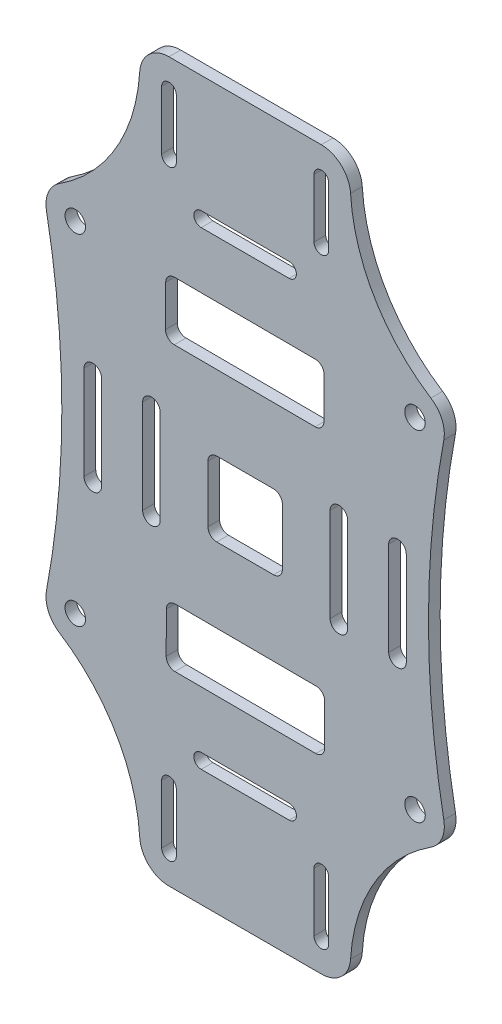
SolidWorks part; units mm, degrees
ref_plane "Front Plane" through (0, 0, 0) normal (0, 0, 1) x (1, 0, 0)
ref_plane "Top Plane" through (0, 0, 0) normal (0, 1, 0) x (1, 0, 0)
ref_plane "Right Plane" through (0, 0, 0) normal (1, 0, 0) x (0, 0, -1)
sketch "Sketch2" plane through (0, 0, 0) normal (0, 0, 1) x (1, 0, 0)
  line L0 (22.5, 22.5) -> (15.25, 15.25) construction
  line L1 (-88.3883, -88.3883) -> (88.3883, -88.3883) construction
  line L2 (-88.3883, -88.3883) -> (-88.3883, 88.3883) construction
  line L3 (88.3883, 88.3883) -> (80.3883, 88.3883) construction
  line L4 (88.3883, -88.3883) -> (88.3883, 88.3883) construction
  line L5 (-22.5, 22.5) -> (-15.25, 15.25) construction
  line L6 (-22.5, -22.5) -> (-15.25, -15.25) construction
  line L7 (15.25, -15.25) -> (22.5, -22.5) construction
  line L8 (-15.25, -15.25) -> (15.25, -15.25) construction
  line L9 (15.25, -15.25) -> (15.25, 15.25) construction
  line L10 (15.25, 15.25) -> (-15.25, 15.25) construction
  line L11 (-15.25, 15.25) -> (-15.25, -15.25) construction
  line L12 (0, 0) -> (28.9914, 28.9914) construction
  line L13 (18.875, 18.875) -> (24.1783, 13.5717) construction
  line L14 (18.875, 18.875) -> (13.4605, 24.0648) construction
  line L16 (16.1678, 21.4699) -> (16.4248, 21.727)
  line L17 (21.4699, 16.1678) -> (21.727, 16.4248)
  line L18 (19.4788, 26.484) -> (23.6395, 29.6392)
  line L19 (26.484, 19.4788) -> (29.6392, 23.6395)
  circle A0 centre (-22.5, 22.5) radius 1.75 construction
  circle A1 centre (22.5, 22.5) radius 1.75 construction
  circle A2 centre (22.5, -22.5) radius 1.75 construction
  circle A3 centre (-22.5, -22.5) radius 1.75 construction
  circle A4 centre (-15.25, 15.25) radius 1.75 construction
  circle A5 centre (15.25, 15.25) radius 1.75 construction
  circle A6 centre (15.25, -15.25) radius 1.75 construction
  circle A7 centre (-15.25, -15.25) radius 1.75 construction
  circle A8 centre (88.3883, 88.3883) radius 3.25
  circle A9 centre (13.4605, 24.0648) radius 1.75
  circle A10 centre (24.1783, 13.5717) radius 1.75
  circle A11 centre (28.9914, 28.9914) radius 1.75
  arc A12 (11.2589, 27.1004) -> (16.1678, 21.4699) centre (13.4605, 24.0648) ccw
  arc A13 (21.5267, 16.2233) -> (27.4519, 11.7425) centre (24.1783, 13.5717) ccw
  arc A14 (25.2432, 28.8737) -> (28.8737, 25.2432) centre (28.9914, 28.9914) ccw
  circle A15 centre (80.3883, 88.3883) radius 1.75
  circle A16 centre (88.3883, 96.3883) radius 1.75
  circle A17 centre (96.3883, 88.3883) radius 1.75
  circle A18 centre (88.3883, 80.3883) radius 1.75
  arc A19 (95.2099, 78.8213) -> (78.8213, 95.2099) centre (88.3883, 88.3883) ccw
  arc A20 (11.2589, 27.1004) -> (78.8213, 95.2099) centre (-163.3974, 267.9184) ccw
  arc A21 (27.1004, 11.2589) -> (95.2099, 78.8213) centre (267.9184, -163.3974) cw
  arc A22 (23.8811, 17.6945) -> (26.484, 19.4788) centre (22.5, 22.5) ccw
  arc A23 (19.4788, 26.484) -> (17.6945, 23.8811) centre (22.5, 22.5) ccw
  arc A24 (29.6392, 23.6395) -> (28.8737, 25.2432) centre (28.8424, 24.2437) ccw
  arc A25 (23.6395, 29.6392) -> (25.2432, 28.8737) centre (24.2437, 28.8424) cw
  arc A26 (23.8811, 17.6945) -> (21.727, 16.4248) centre (25.2623, 12.8891) ccw
  arc A27 (16.4248, 21.727) -> (17.6945, 23.8811) centre (12.8891, 25.2623) ccw
  point P0 (0, 0)
  point P6 (0, 0)
  point P15 (0, 0)
  point P39 (83.085, 93.6916)
  point P40 (23.6881, 34.2947)
  point P47 (93.6916, 83.085)
  point P48 (34.2947, 23.6881)
  point P63 (31.9794, 26.7255)
  point P66 (26.7255, 31.9794)
  dimension "D1" = 4
sketch "Sketch3" plane through (0, 0, 0) normal (0, 0, 1) x (1, 0, 0)
  line L0 (32.5269, -32.5269) -> (37.3859, -27.668)
  line L1 (32.5269, 32.5269) -> (37.3859, 27.668)
  line L2 (32.5269, 32.5269) -> (27.668, 37.3859)
  line L3 (32.5269, -32.5269) -> (27.668, -37.3859)
  line L4 (-32.5269, -32.5269) -> (-27.668, -37.3859)
  line L5 (-32.5269, -32.5269) -> (-37.3859, -27.668)
  line L6 (-32.5269, 32.5269) -> (-37.3859, 27.668)
  line L7 (-32.5269, 32.5269) -> (-27.668, 37.3859)
  line L8 (0, 0) -> (16, 0) construction
  line L9 (16, 0) -> (16, 8) construction
  line L10 (16, 0) -> (16, -8) construction
  line L11 (17.5, 0) -> (17.5, -8)
  line L12 (17.5, 0) -> (17.5, 8)
  line L13 (14.5, 0) -> (14.5, -8)
  line L14 (14.5, 0) -> (14.5, 8)
  line L15 (0, 0) -> (0, 13.4605) construction
  line L16 (24.5, 0) -> (24.5, -8)
  line L17 (27.5, 0) -> (27.5, -8)
  line L18 (27.5, 0) -> (27.5, 8)
  line L19 (24.5, 0) -> (24.5, 8)
  line L20 (-27.5, 0) -> (-27.5, -8)
  line L21 (-24.5, 0) -> (-24.5, -8)
  line L22 (-27.5, 0) -> (-27.5, 8)
  line L23 (-24.5, 0) -> (-24.5, 8)
  line L24 (-14.5, 0) -> (-14.5, 8)
  line L25 (-17.5, 0) -> (-17.5, 8)
  line L26 (-17.5, 0) -> (-17.5, -8)
  line L27 (-14.5, 0) -> (-14.5, -8)
  line L28 (0, 15.25) -> (6.35, 15.25) construction
  line L29 (15.25, 15.25) -> (-15.25, 15.25) construction
  line L30 (0, 15.25) -> (-6.35, 15.25) construction
  line L31 (0, 18.375) -> (4.85, 18.375)
  line L32 (0, 18.375) -> (-4.85, 18.375)
  line L33 (0, 12.125) -> (4.85, 12.125)
  line L34 (0, 12.125) -> (-4.85, 12.125)
  line L35 (6.35, 16.875) -> (6.35, 13.625)
  line L36 (-6.35, 16.875) -> (-6.35, 13.625)
  line L37 (0, -18.375) -> (4.85, -18.375)
  line L38 (6.35, -16.875) -> (6.35, -13.625)
  line L39 (0, -12.125) -> (4.85, -12.125)
  line L40 (0, -12.125) -> (-4.85, -12.125)
  line L41 (-6.35, -16.875) -> (-6.35, -13.625)
  line L42 (0, -18.375) -> (-4.85, -18.375)
  line L43 (0, 18.375) -> (6.35, 18.375) construction
  line L44 (0, 12.125) -> (6.35, 12.125) construction
  line L45 (0, 12.125) -> (-6.35, 12.125) construction
  line L46 (0, 18.375) -> (-6.35, 18.375) construction
  circle A0 centre (28.9914, 28.9914) radius 1.75
  circle A1 centre (24.1783, 13.5717) radius 1.75
  circle A2 centre (22.5, 22.5) radius 1.75
  circle A3 centre (13.4605, 24.0648) radius 1.75
  circle A4 centre (15.25, 15.25) radius 1.75
  circle A5 centre (-15.25, 15.25) radius 1.75
  circle A6 centre (-22.5, 22.5) radius 1.75
  circle A7 centre (-15.25, -15.25) radius 1.75
  circle A8 centre (15.25, -15.25) radius 1.75
  circle A9 centre (22.5, -22.5) radius 1.75
  circle A10 centre (-22.5, -22.5) radius 1.75
  circle A11 centre (24.0648, -13.4605) radius 1.75
  circle A12 centre (13.5717, -24.1783) radius 1.75
  circle A13 centre (28.9914, -28.9914) radius 1.75
  circle A14 centre (-13.4605, -24.0648) radius 1.75
  circle A15 centre (-24.1783, -13.5717) radius 1.75
  circle A16 centre (-28.9914, -28.9914) radius 1.75
  circle A17 centre (-24.0648, 13.4605) radius 1.75
  circle A18 centre (-13.5717, 24.1783) radius 1.75
  circle A19 centre (-28.9914, 28.9914) radius 1.75
  arc A20 (95.2099, 78.8213) -> (27.1004, 11.2589) centre (267.9184, -163.3974) ccw construction
  arc A21 (11.2589, 27.1004) -> (78.8213, 95.2099) centre (-163.3974, 267.9184) ccw construction
  arc A22 (-24.6669, 37.7927) -> (24.6669, 37.7927) centre (0, 81.2846) ccw
  arc A23 (37.7927, 24.6669) -> (37.7927, -24.6669) centre (81.2846, 0) ccw
  arc A24 (24.6669, -37.7927) -> (-24.6669, -37.7927) centre (0, -81.2846) ccw
  arc A25 (-37.7927, -24.6669) -> (-37.7927, 24.6669) centre (-81.2846, 0) ccw
  arc A26 (-37.3859, -27.668) -> (-37.7927, -24.6669) centre (-35.6181, -25.9002) cw
  arc A27 (-27.668, -37.3859) -> (-24.6669, -37.7927) centre (-25.9002, -35.6181) ccw
  arc A28 (27.668, -37.3859) -> (24.6669, -37.7927) centre (25.9002, -35.6181) cw
  arc A29 (37.3859, -27.668) -> (37.7927, -24.6669) centre (35.6181, -25.9002) ccw
  arc A30 (37.3859, 27.668) -> (37.7927, 24.6669) centre (35.6181, 25.9002) cw
  arc A31 (27.668, 37.3859) -> (24.6669, 37.7927) centre (25.9002, 35.6181) ccw
  arc A32 (-37.3859, 27.668) -> (-37.7927, 24.6669) centre (-35.6181, 25.9002) ccw
  arc A33 (-27.668, 37.3859) -> (-24.6669, 37.7927) centre (-25.9002, 35.6181) cw
  arc A34 (17.5, -8) -> (14.5, -8) centre (16, -8) cw
  arc A35 (17.5, 8) -> (14.5, 8) centre (16, 8) ccw
  arc A36 (27.5, -8) -> (24.5, -8) centre (26, -8) cw
  arc A37 (27.5, 8) -> (24.5, 8) centre (26, 8) ccw
  arc A38 (-27.5, -8) -> (-24.5, -8) centre (-26, -8) ccw
  arc A39 (-27.5, 8) -> (-24.5, 8) centre (-26, 8) cw
  arc A40 (-17.5, 8) -> (-14.5, 8) centre (-16, 8) cw
  arc A41 (-17.5, -8) -> (-14.5, -8) centre (-16, -8) ccw
  arc A42 (4.85, -12.125) -> (6.35, -13.625) centre (4.85, -13.625) cw
  arc A43 (4.85, -18.375) -> (6.35, -16.875) centre (4.85, -16.875) ccw
  arc A44 (-4.85, -18.375) -> (-6.35, -16.875) centre (-4.85, -16.875) cw
  arc A45 (-4.85, -12.125) -> (-6.35, -13.625) centre (-4.85, -13.625) ccw
  arc A46 (4.85, 18.375) -> (6.35, 16.875) centre (4.85, 16.875) cw
  arc A47 (4.85, 12.125) -> (6.35, 13.625) centre (4.85, 13.625) ccw
  arc A48 (-4.85, 12.125) -> (-6.35, 13.625) centre (-4.85, 13.625) cw
  arc A49 (-4.85, 18.375) -> (-6.35, 16.875) centre (-4.85, 16.875) ccw
  point P84 (38.7579, 26.296)
  point P87 (26.296, 38.7579)
  point P147 (6.35, -12.125)
  point P150 (6.35, -18.375)
  point P153 (-6.35, -18.375)
  point P156 (-6.35, -12.125)
  point P160 (6.35, 18.375)
  point P164 (6.35, 12.125)
  point P168 (-6.35, 12.125)
  point P172 (-6.35, 18.375)
  dimension "D2" = 4
  dimension "D3" = 4
  dimension "D4" = 2.5
  dimension "D1" = 2
sketch "Sketch4" plane through (0, 0, 0) normal (0, 0, 1) x (1, 0, 0)
  line L0 (-32.5269, 32.5269) -> (-37.3859, 27.668) construction
  line L1 (-32.5269, 32.5269) -> (-27.668, 37.3859) construction
  line L2 (32.5269, 32.5269) -> (27.668, 37.3859) construction
  line L3 (32.5269, 32.5269) -> (37.3859, 27.668) construction
  line L4 (32.5269, -32.5269) -> (37.3859, -27.668) construction
  line L7 (-32.5269, -32.5269) -> (-37.3859, -27.668) construction
  line L8 (-32.5269, 32.5269) -> (-37.3859, 27.668)
  line L9 (-32.5269, 32.5269) -> (-19.4645, 45.5894)
  line L10 (32.5269, 32.5269) -> (19.4645, 45.5894)
  line L11 (32.5269, 32.5269) -> (37.3859, 27.668)
  line L12 (32.5269, -32.5269) -> (37.3859, -27.668)
  line L13 (-26, 8) -> (-26, -8) construction
  line L14 (-16, 8) -> (-16, -8) construction
  line L15 (-32.5269, -32.5269) -> (-37.3859, -27.668)
  line L16 (-38.1181, 25.9002) -> (-38.1181, -25.9002)
  line L17 (38.1181, 25.9002) -> (38.1181, -25.9002)
  line L18 (-13, 56.2846) -> (-13, 46.2846) construction
  line L19 (18, 49.1249) -> (18, 56.2846)
  line L20 (-13, 61.2846) -> (13, 61.2846)
  line L21 (-18, 49.1249) -> (-18, 56.2846)
  line L22 (0, 61.2846) -> (0, 37.7372) construction
  line L23 (-14.25, 56.2846) -> (-14.25, 46.2846)
  line L24 (-11.75, 56.2846) -> (-11.75, 46.2846)
  line L25 (13, 56.2846) -> (13, 46.2846) construction
  line L26 (11.75, 56.2846) -> (11.75, 46.2846)
  line L27 (14.25, 56.2846) -> (14.25, 46.2846)
  line L28 (0, 0) -> (16, 0) construction
  line L29 (-11.75, -56.2846) -> (-11.75, -46.2846)
  line L30 (-14.25, -56.2846) -> (-14.25, -46.2846)
  line L31 (14.25, -56.2846) -> (14.25, -46.2846)
  line L32 (11.75, -56.2846) -> (11.75, -46.2846)
  line L33 (32.5269, -32.5269) -> (19.4645, -45.5894)
  line L34 (18, -49.1249) -> (18, -56.2846)
  line L35 (-13, -61.2846) -> (13, -61.2846)
  line L36 (-18, -49.1249) -> (-18, -56.2846)
  line L37 (-32.5269, -32.5269) -> (-19.4645, -45.5894)
  line L38 (16, 8) -> (16, -8) construction
  line L39 (26, 8) -> (26, -8) construction
  line L40 (-27.5, 8) -> (-27.5, -8)
  line L41 (-17.5, 8) -> (-17.5, -8)
  line L42 (14.5, 8) -> (14.5, -8)
  line L43 (24.5, 8) -> (24.5, -8)
  line L44 (-24.5, 8) -> (-24.5, -8)
  line L45 (-14.5, 8) -> (-14.5, -8)
  line L46 (17.5, 8) -> (17.5, -8)
  line L47 (27.5, 8) -> (27.5, -8)
  line L48 (-13.5717, 24.1783) -> (13.4605, 24.0648) construction
  line L49 (-13.4605, -24.0648) -> (13.5717, -24.1783) construction
  line L50 (-12.0927, 19.172) -> (11.9396, 19.0711)
  line L51 (-11.9816, -29.071) -> (12.0507, -29.172)
  line L52 (-12.0507, 29.172) -> (11.9816, 29.071)
  line L53 (-11.9396, -19.0711) -> (12.0927, -19.172)
  line L54 (-13.5864, 20.6783) -> (-13.557, 27.6783)
  line L55 (13.4458, 20.5648) -> (13.4752, 27.5647)
  line L56 (-13.4752, -27.5647) -> (-13.4458, -20.5648)
  line L57 (13.557, -27.6783) -> (13.5864, -20.6783)
  line L58 (-13.4395, -19.0648) -> (13.5927, -19.1783) construction
  line L59 (-13.4815, -29.0647) -> (13.5507, -29.1783) construction
  line L60 (-13.5927, 19.1783) -> (13.4395, 19.0648) construction
  line L61 (-13.5507, 29.1783) -> (13.4815, 29.0647) construction
  arc A0 (-14.25, 56.2846) -> (-11.75, 56.2846) centre (-13, 56.2846) cw
  arc A1 (-14.25, 46.2846) -> (-11.75, 46.2846) centre (-13, 46.2846) ccw
  arc A2 (14.25, 46.2846) -> (11.75, 46.2846) centre (13, 46.2846) cw
  arc A3 (37.7927, 24.6669) -> (37.3859, 27.668) centre (35.6181, 25.9002) ccw construction
  arc A4 (14.25, 56.2846) -> (11.75, 56.2846) centre (13, 56.2846) ccw
  arc A5 (37.3859, -27.668) -> (37.7927, -24.6669) centre (35.6181, -25.9002) ccw construction
  arc A9 (-37.7927, -24.6669) -> (-37.3859, -27.668) centre (-35.6181, -25.9002) ccw construction
  arc A10 (-14.25, -56.2846) -> (-11.75, -56.2846) centre (-13, -56.2846) ccw
  arc A11 (-37.3859, 27.668) -> (-37.7927, 24.6669) centre (-35.6181, 25.9002) ccw construction
  arc A12 (-19.4645, 45.5894) -> (-18, 49.1249) centre (-23, 49.1249) ccw
  arc A13 (19.4645, 45.5894) -> (18, 49.1249) centre (23, 49.1249) cw
  arc A14 (18, 56.2846) -> (13, 61.2846) centre (13, 56.2846) ccw
  arc A15 (38.1181, 25.9002) -> (37.3859, 27.668) centre (35.6181, 25.9002) ccw
  arc A16 (-13, 61.2846) -> (-18, 56.2846) centre (-13, 56.2846) ccw
  arc A17 (37.3859, -27.668) -> (38.1181, -25.9002) centre (35.6181, -25.9002) ccw
  arc A18 (-27.5, 8) -> (-24.5, 8) centre (-26, 8) cw
  arc A19 (-27.5, -8) -> (-24.5, -8) centre (-26, -8) ccw
  arc A20 (-17.5, 8) -> (-14.5, 8) centre (-16, 8) cw
  arc A21 (-38.1181, -25.9002) -> (-37.3859, -27.668) centre (-35.6181, -25.9002) ccw
  arc A22 (-14.25, -46.2846) -> (-11.75, -46.2846) centre (-13, -46.2846) cw
  arc A23 (-37.3859, 27.668) -> (-38.1181, 25.9002) centre (-35.6181, 25.9002) ccw
  arc A24 (14.25, -46.2846) -> (11.75, -46.2846) centre (13, -46.2846) ccw
  arc A25 (14.25, -56.2846) -> (11.75, -56.2846) centre (13, -56.2846) cw
  arc A26 (19.4645, -45.5894) -> (18, -49.1249) centre (23, -49.1249) ccw
  arc A27 (18, -56.2846) -> (13, -61.2846) centre (13, -56.2846) cw
  arc A28 (-13, -61.2846) -> (-18, -56.2846) centre (-13, -56.2846) cw
  arc A29 (-19.4645, -45.5894) -> (-18, -49.1249) centre (-23, -49.1249) cw
  arc A30 (-17.5, -8) -> (-14.5, -8) centre (-16, -8) ccw
  arc A31 (14.5, 8) -> (17.5, 8) centre (16, 8) cw
  arc A32 (14.5, -8) -> (17.5, -8) centre (16, -8) ccw
  arc A33 (24.5, 8) -> (27.5, 8) centre (26, 8) cw
  arc A34 (24.5, -8) -> (27.5, -8) centre (26, -8) ccw
  arc A35 (12.0927, -19.172) -> (13.5864, -20.6783) centre (12.0864, -20.672) cw
  arc A36 (12.0507, -29.172) -> (13.557, -27.6783) centre (12.057, -27.672) ccw
  arc A37 (-11.9816, -29.071) -> (-13.4752, -27.5647) centre (-11.9753, -27.571) cw
  arc A38 (-11.9396, -19.0711) -> (-13.4458, -20.5648) centre (-11.9459, -20.5711) ccw
  arc A39 (11.9396, 19.0711) -> (13.4458, 20.5648) centre (11.9459, 20.5711) ccw
  arc A40 (11.9816, 29.071) -> (13.4752, 27.5647) centre (11.9753, 27.571) cw
  arc A41 (-12.0927, 19.172) -> (-13.5864, 20.6783) centre (-12.0864, 20.672) cw
  arc A42 (-12.0507, 29.172) -> (-13.557, 27.6783) centre (-12.057, 27.672) ccw
  circle A43 centre (-28.9914, 28.9914) radius 1.75
  circle A44 centre (28.9914, 28.9914) radius 1.75
  circle A45 centre (28.9914, -28.9914) radius 1.75
  circle A46 centre (-28.9914, -28.9914) radius 1.75
  point P36 (18, 31.2846)
  point P37 (18, 61.2846)
  point P39 (-18, 31.2846)
  point P40 (-18, 61.2846)
  dimension "D1" = 1.5
sketch "Sketch5" plane through (0, 0, 0) normal (0, 0, 1) x (1, 0, 0)
  line L0 (18, 49.1249) -> (18, 56.2846) construction
  line L1 (-13, 61.2846) -> (13, 61.2846) construction
  line L2 (-18, 49.1249) -> (-18, 56.2846) construction
  line L3 (-14.25, 56.2846) -> (-14.25, 46.2846) construction
  line L4 (-11.75, 56.2846) -> (-11.75, 46.2846) construction
  line L5 (11.75, 56.2846) -> (11.75, 46.2846) construction
  line L6 (14.25, 56.2846) -> (14.25, 46.2846) construction
  line L7 (18, -49.1249) -> (18, -56.2846) construction
  line L8 (-13, -61.2846) -> (13, -61.2846) construction
  line L9 (-18, -49.1249) -> (-18, -56.2846) construction
  line L10 (-14.25, -56.2846) -> (-14.25, -46.2846) construction
  line L11 (-11.75, -56.2846) -> (-11.75, -46.2846) construction
  line L12 (11.75, -56.2846) -> (11.75, -46.2846) construction
  line L13 (14.25, -56.2846) -> (14.25, -46.2846) construction
  line L14 (18, 32.3569) -> (18, 56.2846)
  line L15 (-13, 61.2846) -> (13, 61.2846)
  line L16 (-18, 32.3569) -> (-18, 56.2846)
  line L17 (-14.25, 56.2846) -> (-14.25, 46.2846)
  line L18 (-11.75, 56.2846) -> (-11.75, 46.2846)
  line L19 (11.75, 56.2846) -> (11.75, 46.2846)
  line L20 (14.25, 56.2846) -> (14.25, 46.2846)
  line L21 (18, -32.3569) -> (18, -56.2846)
  line L22 (-13, -61.2846) -> (13, -61.2846)
  line L23 (-18, -32.3569) -> (-18, -56.2846)
  line L24 (-14.25, -56.2846) -> (-14.25, -46.2846)
  line L25 (-11.75, -56.2846) -> (-11.75, -46.2846)
  line L26 (11.75, -56.2846) -> (11.75, -46.2846)
  line L27 (14.25, -56.2846) -> (14.25, -46.2846)
  line L28 (-12.0507, 29.172) -> (11.9816, 29.071) construction
  line L29 (13.4458, 20.5648) -> (13.4752, 27.5647) construction
  line L30 (-12.0927, 19.172) -> (11.9396, 19.0711) construction
  line L31 (-13.5864, 20.6783) -> (-13.557, 27.6783) construction
  line L32 (27.5, 0) -> (27.5, 8) construction
  line L33 (24.5, 0) -> (24.5, 8) construction
  line L34 (24.5, 0) -> (24.5, -8) construction
  line L35 (27.5, 0) -> (27.5, -8) construction
  line L36 (17.5, 0) -> (17.5, 8) construction
  line L37 (17.5, 0) -> (17.5, -8) construction
  line L38 (14.5, 0) -> (14.5, -8) construction
  line L39 (14.5, 0) -> (14.5, 8) construction
  line L40 (-14.5, 0) -> (-14.5, 8) construction
  line L41 (-14.5, 0) -> (-14.5, -8) construction
  line L42 (-17.5, 0) -> (-17.5, -8) construction
  line L43 (-17.5, 0) -> (-17.5, 8) construction
  line L44 (-24.5, 0) -> (-24.5, 8) construction
  line L45 (-27.5, 0) -> (-27.5, 8) construction
  line L46 (-27.5, 0) -> (-27.5, -8) construction
  line L47 (-24.5, 0) -> (-24.5, -8) construction
  line L48 (-11.9396, -19.0711) -> (12.0927, -19.172) construction
  line L49 (-13.4752, -27.5647) -> (-13.4458, -20.5648) construction
  line L50 (-11.9816, -29.071) -> (12.0507, -29.172) construction
  line L51 (13.557, -27.6783) -> (13.5864, -20.6783) construction
  line L52 (-12.0507, 29.172) -> (11.9816, 29.071)
  line L53 (13.4458, 20.5648) -> (13.4752, 27.5647)
  line L54 (-12.0927, 19.172) -> (11.9396, 19.0711)
  line L55 (-13.5864, 20.6783) -> (-13.557, 27.6783)
  line L56 (27.5, 0) -> (27.5, 8)
  line L57 (24.5, 0) -> (24.5, 8)
  line L58 (24.5, 0) -> (24.5, -8)
  line L59 (27.5, 0) -> (27.5, -8)
  line L60 (17.5, 0) -> (17.5, 8)
  line L61 (17.5, 0) -> (17.5, -8)
  line L62 (14.5, 0) -> (14.5, -8)
  line L63 (14.5, 0) -> (14.5, 8)
  line L64 (-14.5, 0) -> (-14.5, 8)
  line L65 (-14.5, 0) -> (-14.5, -8)
  line L66 (-17.5, 0) -> (-17.5, -8)
  line L67 (-17.5, 0) -> (-17.5, 8)
  line L68 (-24.5, 0) -> (-24.5, 8)
  line L69 (-27.5, 0) -> (-27.5, 8)
  line L70 (-27.5, 0) -> (-27.5, -8)
  line L71 (-24.5, 0) -> (-24.5, -8)
  line L72 (-11.9396, -19.0711) -> (12.0927, -19.172)
  line L73 (-13.4752, -27.5647) -> (-13.4458, -20.5648)
  line L74 (-11.9816, -29.071) -> (12.0507, -29.172)
  line L75 (13.557, -27.6783) -> (13.5864, -20.6783)
  line L76 (-13, 45.0346) -> (13, 45.0346) construction
  line L77 (0, 45.0346) -> (0, 40.0346) construction
  line L78 (0, 40.0346) -> (7.5, 40.0346) construction
  line L79 (0, 40.0346) -> (-7.5, 40.0346) construction
  line L80 (0, 41.2846) -> (7.5, 41.2846)
  line L81 (0, 41.2846) -> (-7.5, 41.2846)
  line L82 (0, 38.7846) -> (7.5, 38.7846)
  line L83 (0, 38.7846) -> (-7.5, 38.7846)
  line L84 (-14.5, 0) -> (14.5, 0) construction
  line L85 (0, -40.0346) -> (-7.5, -40.0346) construction
  line L86 (0, -40.0346) -> (7.5, -40.0346) construction
  line L87 (0, -38.7846) -> (-7.5, -38.7846)
  line L88 (0, -38.7846) -> (7.5, -38.7846)
  line L89 (0, -41.2846) -> (-7.5, -41.2846)
  line L90 (0, -41.2846) -> (7.5, -41.2846)
  line L92 (-4.85, 6.35) -> (4.85, 6.35)
  line L93 (-6.35, 4.85) -> (-6.35, -4.85)
  line L94 (-4.85, -6.35) -> (4.85, -6.35)
  line L95 (6.35, 4.85) -> (6.35, -4.85)
  line L96 (-6.35, 6.35) -> (6.35, -6.35) construction
  line L97 (-6.35, -6.35) -> (6.35, 6.35) construction
  circle A0 centre (28.9914, 28.9914) radius 1.75
  circle A1 centre (28.9914, -28.9914) radius 1.75
  circle A2 centre (-28.9914, -28.9914) radius 1.75
  circle A3 centre (-28.9914, 28.9914) radius 1.75
  arc A4 (-28.0658, 33.905) -> (-33.905, 28.0658) centre (-28.9914, 28.9914) ccw
  arc A5 (33.905, 28.0658) -> (28.0658, 33.905) centre (28.9914, 28.9914) ccw
  arc A6 (28.0658, -33.905) -> (33.905, -28.0658) centre (28.9914, -28.9914) ccw
  arc A7 (-33.905, -28.0658) -> (-28.0658, -33.905) centre (-28.9914, -28.9914) ccw
  arc A8 (33.905, 28.0658) -> (33.905, -28.0658) centre (182.8964, 0) ccw
  arc A9 (28.0658, -33.905) -> (18, -32.3569) centre (0, -182.8964) ccw
  arc A10 (-33.905, -28.0658) -> (-33.905, 28.0658) centre (-182.8964, 0) ccw
  arc A11 (-28.0658, 33.905) -> (-18, 32.3569) centre (0, 182.8964) ccw
  arc A12 (18, 56.2846) -> (13, 61.2846) centre (13, 56.2846) ccw construction
  arc A13 (-13, 61.2846) -> (-18, 56.2846) centre (-13, 56.2846) ccw construction
  arc A14 (-11.75, 56.2846) -> (-14.25, 56.2846) centre (-13, 56.2846) ccw construction
  arc A15 (-14.25, 46.2846) -> (-11.75, 46.2846) centre (-13, 46.2846) ccw construction
  arc A16 (14.25, 56.2846) -> (11.75, 56.2846) centre (13, 56.2846) ccw construction
  arc A17 (11.75, 46.2846) -> (14.25, 46.2846) centre (13, 46.2846) ccw construction
  arc A18 (13, -61.2846) -> (18, -56.2846) centre (13, -56.2846) ccw construction
  arc A19 (-18, -56.2846) -> (-13, -61.2846) centre (-13, -56.2846) ccw construction
  arc A20 (-11.75, -46.2846) -> (-14.25, -46.2846) centre (-13, -46.2846) ccw construction
  arc A21 (-14.25, -56.2846) -> (-11.75, -56.2846) centre (-13, -56.2846) ccw construction
  arc A22 (11.75, -56.2846) -> (14.25, -56.2846) centre (13, -56.2846) ccw construction
  arc A23 (14.25, -46.2846) -> (11.75, -46.2846) centre (13, -46.2846) ccw construction
  arc A24 (18, 56.2846) -> (13, 61.2846) centre (13, 56.2846) ccw
  arc A25 (-13, 61.2846) -> (-18, 56.2846) centre (-13, 56.2846) ccw
  arc A26 (-11.75, 56.2846) -> (-14.25, 56.2846) centre (-13, 56.2846) ccw
  arc A27 (-14.25, 46.2846) -> (-11.75, 46.2846) centre (-13, 46.2846) ccw
  arc A28 (14.25, 56.2846) -> (11.75, 56.2846) centre (13, 56.2846) ccw
  arc A29 (11.75, 46.2846) -> (14.25, 46.2846) centre (13, 46.2846) ccw
  arc A30 (13, -61.2846) -> (18, -56.2846) centre (13, -56.2846) ccw
  arc A31 (-18, -56.2846) -> (-13, -61.2846) centre (-13, -56.2846) ccw
  arc A32 (-11.75, -46.2846) -> (-14.25, -46.2846) centre (-13, -46.2846) ccw
  arc A33 (-14.25, -56.2846) -> (-11.75, -56.2846) centre (-13, -56.2846) ccw
  arc A34 (11.75, -56.2846) -> (14.25, -56.2846) centre (13, -56.2846) ccw
  arc A35 (14.25, -46.2846) -> (11.75, -46.2846) centre (13, -46.2846) ccw
  arc A36 (18, 32.3569) -> (28.0658, 33.905) centre (0, 182.8964) ccw
  arc A37 (-18, -32.3569) -> (-28.0658, -33.905) centre (0, -182.8964) ccw
  arc A38 (13.4752, 27.5647) -> (11.9816, 29.071) centre (11.9753, 27.571) ccw construction
  arc A39 (11.9396, 19.0711) -> (13.4458, 20.5648) centre (11.9459, 20.5711) ccw construction
  arc A40 (-12.0507, 29.172) -> (-13.557, 27.6783) centre (-12.057, 27.672) ccw construction
  arc A41 (-13.5864, 20.6783) -> (-12.0927, 19.172) centre (-12.0864, 20.672) ccw construction
  arc A42 (27.5, 8) -> (24.5, 8) centre (26, 8) ccw construction
  arc A43 (24.5, -8) -> (27.5, -8) centre (26, -8) ccw construction
  arc A44 (17.5, 8) -> (14.5, 8) centre (16, 8) ccw construction
  arc A45 (14.5, -8) -> (17.5, -8) centre (16, -8) ccw construction
  arc A46 (-17.5, -8) -> (-14.5, -8) centre (-16, -8) ccw construction
  arc A47 (-14.5, 8) -> (-17.5, 8) centre (-16, 8) ccw construction
  arc A48 (-24.5, 8) -> (-27.5, 8) centre (-26, 8) ccw construction
  arc A49 (-27.5, -8) -> (-24.5, -8) centre (-26, -8) ccw construction
  arc A50 (-11.9396, -19.0711) -> (-13.4458, -20.5648) centre (-11.9459, -20.5711) ccw construction
  arc A51 (-13.4752, -27.5647) -> (-11.9816, -29.071) centre (-11.9753, -27.571) ccw construction
  arc A52 (12.0507, -29.172) -> (13.557, -27.6783) centre (12.057, -27.672) ccw construction
  arc A53 (13.5864, -20.6783) -> (12.0927, -19.172) centre (12.0864, -20.672) ccw construction
  arc A54 (13.4752, 27.5647) -> (11.9816, 29.071) centre (11.9753, 27.571) ccw
  arc A55 (11.9396, 19.0711) -> (13.4458, 20.5648) centre (11.9459, 20.5711) ccw
  arc A56 (-12.0507, 29.172) -> (-13.557, 27.6783) centre (-12.057, 27.672) ccw
  arc A57 (-13.5864, 20.6783) -> (-12.0927, 19.172) centre (-12.0864, 20.672) ccw
  arc A58 (27.5, 8) -> (24.5, 8) centre (26, 8) ccw
  arc A59 (24.5, -8) -> (27.5, -8) centre (26, -8) ccw
  arc A60 (17.5, 8) -> (14.5, 8) centre (16, 8) ccw
  arc A61 (14.5, -8) -> (17.5, -8) centre (16, -8) ccw
  arc A62 (-17.5, -8) -> (-14.5, -8) centre (-16, -8) ccw
  arc A63 (-14.5, 8) -> (-17.5, 8) centre (-16, 8) ccw
  arc A64 (-24.5, 8) -> (-27.5, 8) centre (-26, 8) ccw
  arc A65 (-27.5, -8) -> (-24.5, -8) centre (-26, -8) ccw
  arc A66 (-11.9396, -19.0711) -> (-13.4458, -20.5648) centre (-11.9459, -20.5711) ccw
  arc A67 (-13.4752, -27.5647) -> (-11.9816, -29.071) centre (-11.9753, -27.571) ccw
  arc A68 (12.0507, -29.172) -> (13.557, -27.6783) centre (12.057, -27.672) ccw
  arc A69 (13.5864, -20.6783) -> (12.0927, -19.172) centre (12.0864, -20.672) ccw
  arc A70 (7.5, 41.2846) -> (7.5, 38.7846) centre (7.5, 40.0346) cw
  arc A71 (-7.5, 41.2846) -> (-7.5, 38.7846) centre (-7.5, 40.0346) ccw
  arc A72 (-7.5, -41.2846) -> (-7.5, -38.7846) centre (-7.5, -40.0346) cw
  arc A73 (7.5, -41.2846) -> (7.5, -38.7846) centre (7.5, -40.0346) ccw
  arc A74 (4.85, -6.35) -> (6.35, -4.85) centre (4.85, -4.85) ccw
  arc A75 (-6.35, -4.85) -> (-4.85, -6.35) centre (-4.85, -4.85) ccw
  arc A76 (-4.85, 6.35) -> (-6.35, 4.85) centre (-4.85, 4.85) ccw
  arc A77 (4.85, 6.35) -> (6.35, 4.85) centre (4.85, 4.85) cw
  point P142 (0, 0)
  dimension "D1" = 1.5
extrude "Boss-Extrude2" add sketch "Sketch5" along normal blind 2
fillet "Fillet1" radius 30 4 edges at (18, -32.3569, 1) (-18, -32.3569, 1) (-18, 32.3569, 1) (18, 32.3569, 1)
